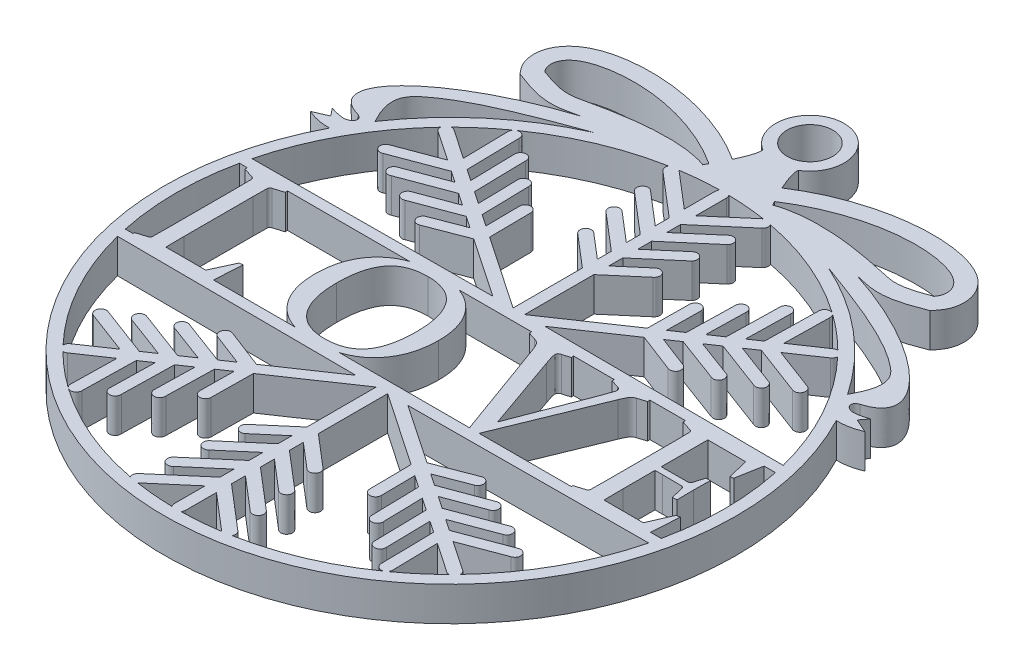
SolidWorks part; units mm, degrees
ref_plane "Front" through (0, 0, 0) normal (0, 0, 1) x (1, 0, 0)
ref_plane "Top" through (0, 0, 0) normal (0, 1, 0) x (1, 0, 0)
ref_plane "Right" through (0, 0, 0) normal (1, 0, 0) x (0, 0, -1)
sketch "Sketch2" plane through (0, 0, 0) normal (0, 1, 0) x (1, 0, 0)
  line L0 (0, -40) -> (0, 40) construction
  line L1 (-1.5513, 28.9322) -> (-1.4355, 28.0386) construction
  line L2 (-1.4355, 28.0386) -> (-3.2765, 24.7844) construction
  line L3 (-25, 0) -> (25, 0) construction
  line L4 (-23.5816, 13.2421) -> (-23.0551, 12.5703)
  line L5 (-23.0551, 12.5703) -> (-24.2994, 12.0278)
  line L6 (1.5513, 28.9322) -> (1.4355, 28.0386) construction
  line L7 (1.4355, 28.0386) -> (3.2765, 24.7844) construction
  line L8 (23.0551, 12.5703) -> (24.2994, 12.0278)
  line L9 (23.5816, 13.2421) -> (23.0551, 12.5703)
  circle A0 centre (0, 0) radius 25
  circle A1 centre (0, 31.5) radius 3
  circle A2 centre (0, 31.5) radius 2
  spline S0 degree 2 poles (-1.5513, 28.9322) (-1.4355, 28.0386) (-3.2765, 24.7844) knots 0 0 0 1 1 1
  spline S1 degree 3 poles (-20.6762, 14.0533) (-22.1036, 16.6017) (-19.7069, 19.1431) (-14.9545, 21.2685) (-6.9225, 24.0225) knots 0 0 0 0 0.333759 1 1 1 1
  spline S2 degree 3 poles (-2.8625, 25.5162) (-5.0851, 26.981) (-8.4172, 28.2104) (-13.6179, 28.5846) (-17.3038, 27.8244) (-17.5189, 25.8959) (-17.0454, 25.3119) knots 0.352292 0.352292 0.352292 0.352292 0.605498 0.656456 0.861874 1 1 1 1
  spline S3 degree 3 poles (-17.0454, 25.3119) (-14.9087, 24.481) (-13.5639, 24.7008) (-11.9333, 25.1069) (-8.4964, 25.7) (-5.0745, 25.9342) (-3.0588, 25.1693) knots 0 0 0 0 0.312735 0.538742 0.603058 0.955894 0.955894 0.955894 0.955894
  spline S4 degree 3 poles (21.9849, 13.3203) (22.1277, 13.5754) (22.4052, 14.1154) (22.7907, 15.0833) (23.0346, 16.2585) (22.7929, 17.6393) (22.101, 18.6611) (21.3618, 19.2961) (20.4903, 19.9352) (19.1911, 20.7514) (17.2586, 21.7212) (15.196, 22.5997) (13.1968, 23.3764) (11.5041, 24.0041) (9.9548, 24.5574) (8.8094, 24.958) (8.0923, 25.2065) (7.661, 25.355) (7.409, 25.4414) knots 0 0 0 0 0.03125 0.0625 0.125 0.1875 0.25 0.3125 0.375 0.5 0.625 0.75 0.8125 0.875 0.9375 0.964353 0.978612 1 1 1 1 construction
  spline S5 degree 3 poles (12.1078, 23.5145) (20.9973, 20.6606) (26.5831, 15.1958) (21.9849, 13.8893) knots 0.159399 0.159399 0.159399 0.159399 0.848923 0.848923 0.848923 0.848923
  spline S6 degree 3 poles (-2.1123, 26.8423) (-3.7352, 27.9119) (-6.4655, 29.1184) (-10.2583, 29.8928) (-13.084, 30.013) (-15.2668, 29.7046) (-16.7949, 29.1431) (-17.8412, 28.4814) (-18.6487, 27.4403) (-18.9074, 26.3618) (-18.7916, 25.4645) (-18.5606, 24.8375) (-18.1909, 24.3381) (-18.0722, 24.1975) (-17.996, 24.1025) (-17.96, 24.0581) knots 0.352292 0.352292 0.352292 0.352292 0.520312 0.604321 0.688331 0.772341 0.814346 0.85635 0.898355 0.94036 0.961362 0.982365 1.003367 1.013868 1.02437 1.02437 1.02437 1.02437
  spline S7 degree 3 poles (-17.96, 24.0581) (-17.5452, 23.8968) (-16.6622, 23.5595) (-15.608, 23.2763) (-14.6788, 23.1423) (-13.863, 23.1573) (-13.1986, 23.2698) (-12.7285, 23.3761) (-12.3212, 23.4677) (-11.9543, 23.5484) (-11.5324, 23.6374) (-10.9181, 23.7583) (-9.7068, 23.9714) (-8.2109, 24.1695) (-6.8748, 24.2333) (-6.3289, 24.2308) (-6.1677, 24.2272) knots -0.018096 -0.018096 -0.018096 -0.018096 0.042779 0.103653 0.164528 0.225402 0.286276 0.347151 0.402446 0.432883 0.468899 0.529774 0.590648 0.712397 0.773271 0.799158 0.799158 0.799158 0.799158
  spline S8 degree 2 poles (24.2994, 12.0278) (23.2006, 11.561) (22.1374, 11.6161) knots 0 0 0 0.62225 0.62225 0.62225
  spline S9 degree 3 poles (-21.9849, 13.3203) (-22.1277, 13.5754) (-22.4052, 14.1154) (-22.7907, 15.0833) (-23.0346, 16.2585) (-22.7929, 17.6393) (-22.101, 18.6611) (-21.3618, 19.2961) (-20.4903, 19.9352) (-19.1911, 20.7514) (-17.2586, 21.7212) (-15.196, 22.5997) (-13.1968, 23.3764) (-11.5041, 24.0041) (-9.9548, 24.5574) (-8.8094, 24.958) (-8.0923, 25.2065) (-7.661, 25.355) (-7.409, 25.4414) knots 0 0 0 0 0.03125 0.0625 0.125 0.1875 0.25 0.3125 0.375 0.5 0.625 0.75 0.8125 0.875 0.9375 0.964353 0.978612 1 1 1 1 construction
  spline S10 degree 3 poles (-7.409, 25.4414) (-7.4118, 25.4404) (-8.0863, 25.2093) (-8.4188, 25.0933) knots 0 0 0 0 0.024048 0.024048 0.024048 0.024048
  spline S11 degree 3 poles (-21.9849, 13.8893) (-21.4255, 13.6594) (-21.5668, 13.144) (-22.3704, 12.916) (-23.1797, 13.0883) (-23.5816, 13.2421) knots 0 0 0 0 0.635839 0.735839 1 1 1 1
  spline S12 degree 2 poles (-24.2994, 12.0278) (-23.2006, 11.561) (-22.1374, 11.6161) knots 0 0 0 0.62225 0.62225 0.62225
  spline S13 degree 3 poles (-12.1078, 23.5145) (-20.9973, 20.6606) (-26.5831, 15.1958) (-21.9849, 13.8893) knots 0.159399 0.159399 0.159399 0.159399 0.848923 0.848923 0.848923 0.848923
  spline S14 degree 3 poles (21.9849, 13.8893) (21.4255, 13.6594) (21.5668, 13.144) (22.3704, 12.916) (23.1797, 13.0883) (23.5816, 13.2421) knots 0 0 0 0 0.635839 0.735839 1 1 1 1
  spline S15 degree 3 poles (7.409, 25.4414) (7.4118, 25.4404) (8.0863, 25.2093) (8.4188, 25.0933) knots 0 0 0 0 0.024048 0.024048 0.024048 0.024048
  spline S16 degree 3 poles (17.96, 24.0581) (17.5452, 23.8968) (16.6622, 23.5595) (15.608, 23.2763) (14.6788, 23.1423) (13.863, 23.1573) (13.1986, 23.2698) (12.7285, 23.3761) (12.3212, 23.4677) (11.9543, 23.5484) (11.5324, 23.6374) (10.9181, 23.7583) (9.7068, 23.9714) (8.2109, 24.1695) (6.8748, 24.2333) (6.3289, 24.2308) (6.1677, 24.2272) knots -0.018096 -0.018096 -0.018096 -0.018096 0.042779 0.103653 0.164528 0.225402 0.286276 0.347151 0.402446 0.432883 0.468899 0.529774 0.590648 0.712397 0.773271 0.799158 0.799158 0.799158 0.799158
  spline S17 degree 3 poles (2.1123, 26.8423) (3.7352, 27.9119) (6.4655, 29.1184) (10.2583, 29.8928) (13.084, 30.013) (15.2668, 29.7046) (16.7949, 29.1431) (17.8412, 28.4814) (18.6487, 27.4403) (18.9074, 26.3618) (18.7916, 25.4645) (18.5606, 24.8375) (18.1909, 24.3381) (18.0722, 24.1975) (17.996, 24.1025) (17.96, 24.0581) knots 0.352292 0.352292 0.352292 0.352292 0.520312 0.604321 0.688331 0.772341 0.814346 0.85635 0.898355 0.94036 0.961362 0.982365 1.003367 1.013868 1.02437 1.02437 1.02437 1.02437
  spline S18 degree 3 poles (17.0454, 25.3119) (14.9087, 24.481) (13.5639, 24.7008) (11.9333, 25.1069) (8.4964, 25.7) (5.0745, 25.9342) (3.0588, 25.1693) knots 0 0 0 0 0.312735 0.538742 0.603058 0.955894 0.955894 0.955894 0.955894
  spline S19 degree 3 poles (2.8625, 25.5162) (5.0851, 26.981) (8.4172, 28.2104) (13.6179, 28.5846) (17.3038, 27.8244) (17.5189, 25.8959) (17.0454, 25.3119) knots 0.352292 0.352292 0.352292 0.352292 0.605498 0.656456 0.861874 1 1 1 1
  spline S20 degree 3 poles (20.6762, 14.0533) (22.1036, 16.6017) (19.7069, 19.1431) (14.9545, 21.2685) (6.9225, 24.0225) knots 0 0 0 0 0.333759 1 1 1 1
  spline S21 degree 2 poles (1.5513, 28.9322) (1.4355, 28.0386) (3.2765, 24.7844) knots 0 0 0 1 1 1
  point P5 (0, 0)
sketch "Sketch3" plane through (0, 0, 0) normal (0, 1, 0) x (1, 0, 0)
  line L0 (-24.1349, 0) -> (24.1349, 0) construction
  line L2 (0, -40) -> (0, 40) construction
  line L3 (-0.5022, -6) -> (0.5022, -6) construction
  line L5 (-14.034, -15.1774) -> (-13.0234, -14.492) construction
  line L8 (-12.03, -13.8183) -> (-11.0201, -13.1334) construction
  line L9 (-9.9505, -12.408) -> (-8.9402, -11.7227) construction
  line L10 (-7.9131, -11.0261) -> (-6.9051, -10.3425) construction
  line L11 (-7.4472, -14.0019) -> (-7.4091, -10.6843) construction
  line L22 (-9.5313, -15.9262) -> (-9.4454, -12.0654) construction
  line L30 (-11.6104, -17.755) -> (-11.5251, -13.4758) construction
  line L31 (-9.9505, -12.408) -> (-11.0201, -13.1334)
  line L34 (-13.6099, -19.1638) -> (-13.5287, -14.8347) construction
  line L35 (-14.034, -15.1774) -> (-16.6227, -16.9331)
  line L39 (-2.2838, -6) -> (-0.5022, -6) construction
  line L40 (-0.7828, -5.5862) -> (-16.9034, -16.5193) construction
  line L41 (-2.2838, -6) -> (-7.4664, -9.5149)
  line L42 (-12.03, -13.8183) -> (-13.0234, -14.492)
  line L43 (-18.1421, -12.4812) -> (-14.09, -14.0071) construction
  line L44 (-7.9131, -11.0261) -> (-8.9402, -11.7227)
  line L45 (-0.5022, -6) -> (-1.0635, -5.1724) construction
  line L46 (14.5953, -14.3498) -> (13.5847, -13.6643) construction
  line L47 (-16.0936, -11.1447) -> (-12.0864, -12.6482) construction
  line L48 (-7.9131, -11.0261) -> (-7.9472, -13.9949)
  line L49 (-13.6255, -9.8895) -> (-10.0067, -11.2377) construction
  line L51 (-11.0668, -8.665) -> (-7.9704, -9.8567) construction
  line L63 (-8.4743, -10.1985) -> (-7.4664, -9.5149) construction
  line L64 (-10.5118, -11.5803) -> (-9.5015, -10.8951) construction
  line L65 (-12.5913, -12.9907) -> (-11.5814, -12.3057) construction
  line L66 (-14.5953, -14.3498) -> (-13.5847, -13.6643) construction
  line L67 (-13.5847, -13.6643) -> (-17.9319, -12.0275)
  line L68 (-7.4664, -9.5149) -> (-10.8883, -8.1979)
  line L69 (-9.5015, -10.8951) -> (-13.3999, -9.4433)
  line L70 (-11.5814, -12.3057) -> (-15.8731, -10.6959)
  line L71 (-9.9505, -12.408) -> (-10.028, -15.8688)
  line L72 (-12.03, -13.8183) -> (-12.1079, -17.7047)
  line L73 (-14.5953, -14.3498) -> (-18.2881, -12.9594)
  line L74 (-12.5913, -12.9907) -> (-16.2309, -11.6254)
  line L75 (-10.5118, -11.5803) -> (-13.7559, -10.3722)
  line L76 (-8.4743, -10.1985) -> (-11.2452, -9.132)
  line L77 (-8.4743, -10.1985) -> (-9.5015, -10.8951)
  line L78 (-0.5022, -6) -> (-6.9051, -10.3425)
  line L79 (-12.5913, -12.9907) -> (-13.5847, -13.6643)
  line L80 (-14.5953, -14.3498) -> (-17.184, -16.1055)
  line L81 (-10.5118, -11.5803) -> (-11.5814, -12.3057)
  line L82 (12.5913, -12.9907) -> (11.5814, -12.3057) construction
  line L83 (10.5118, -11.5803) -> (9.5015, -10.8951) construction
  line L84 (8.4743, -10.1985) -> (7.4664, -9.5149) construction
  line L85 (11.0668, -8.665) -> (7.9704, -9.8567) construction
  line L86 (-14.034, -15.1774) -> (-14.1082, -19.1225)
  line L87 (13.6255, -9.8895) -> (10.0067, -11.2377) construction
  line L88 (16.0936, -11.1447) -> (12.0864, -12.6482) construction
  line L89 (0.5022, -6) -> (1.0635, -5.1724) construction
  line L90 (18.1421, -12.4812) -> (14.09, -14.0071) construction
  line L91 (0.7828, -5.5862) -> (16.9034, -16.5193) construction
  line L92 (2.2838, -6) -> (0.5022, -6) construction
  line L93 (13.6099, -19.1638) -> (13.5287, -14.8347) construction
  line L94 (11.6104, -17.755) -> (11.5251, -13.4758) construction
  line L95 (9.5313, -15.9262) -> (9.4454, -12.0654) construction
  line L96 (7.4472, -14.0019) -> (7.4091, -10.6843) construction
  line L97 (7.9131, -11.0261) -> (6.9051, -10.3425) construction
  line L98 (9.9505, -12.408) -> (8.9402, -11.7227) construction
  line L99 (12.03, -13.8183) -> (11.0201, -13.1334) construction
  line L100 (14.034, -15.1774) -> (13.0234, -14.492) construction
  line L101 (-0.5022, -13.3802) -> (-0.5022, -14.6022)
  line L102 (-0.5022, -14.6022) -> (-3.7641, -17.3917)
  line L103 (23.4056, -5.8885) -> (23.6113, -5)
  line L104 (0.5022, -20.994) -> (3.6955, -23.7248)
  line L105 (23.4056, -5.8885) -> (2.2838, -6)
  line L106 (0.5022, -6) -> (0.5022, -12.0665)
  line L107 (-11.0201, -13.1334) -> (-11.112, -17.7161)
  line L108 (-8.9402, -11.7227) -> (-9.0333, -15.8817)
  line L109 (-6.9051, -10.3425) -> (-6.9473, -14.0089)
  line L110 (-0.5022, -12.0665) -> (-3.2976, -14.457)
  line L111 (0.5022, -20.994) -> (0.5022, -23.6884)
  line L112 (-0.5022, -15.9167) -> (-0.5022, -17.1387)
  line L113 (13.0234, -14.492) -> (13.1107, -19.1364)
  line L114 (-0.5022, -13.3802) -> (-2.7221, -15.2785)
  line L115 (-0.5022, -19.674) -> (-4.3475, -22.9624)
  line L116 (-0.5022, -17.1387) -> (-4.0537, -20.1758)
  line L117 (-0.5022, -18.452) -> (-3.3506, -20.8878)
  line L118 (-0.5022, -15.9167) -> (-3.0462, -18.0922)
  line L119 (0.5022, -18.452) -> (0.5022, -19.674)
  line L120 (-0.5022, -18.452) -> (-0.5022, -19.674)
  line L121 (0.5022, -15.9167) -> (3.0462, -18.0922)
  line L122 (0.5022, -18.452) -> (3.3506, -20.8878)
  line L123 (-13.0234, -14.492) -> (-13.1107, -19.1364)
  line L124 (-0.5022, -20.994) -> (-0.5022, -23.6884)
  line L125 (0.5022, -17.1387) -> (4.0537, -20.1758)
  line L126 (-0.5022, -6) -> (-0.5022, -12.0665)
  line L127 (-23.4056, -5.8885) -> (-2.2838, -6)
  line L128 (-0.5022, -20.994) -> (-3.6955, -23.7248)
  line L129 (-23.6113, -5) -> (23.6113, -5)
  line L130 (0.5022, -19.674) -> (4.3475, -22.9624)
  line L131 (-23.4056, -5.8885) -> (-23.6113, -5)
  line L132 (0.5022, -13.3802) -> (2.7221, -15.2785)
  line L133 (0.5022, -15.9167) -> (0.5022, -17.1387)
  line L139 (0.5022, -12.0665) -> (3.2976, -14.457)
  line L141 (6.9051, -10.3425) -> (6.9473, -14.0089)
  line L174 (8.9402, -11.7227) -> (9.0333, -15.8817)
  line L175 (11.0201, -13.1334) -> (11.112, -17.7161)
  line L176 (0.5022, -14.6022) -> (3.7641, -17.3917)
  line L177 (0.5022, -13.3802) -> (0.5022, -14.6022)
  line L178 (14.034, -15.1774) -> (14.1082, -19.1225)
  line L179 (10.5118, -11.5803) -> (11.5814, -12.3057)
  line L180 (14.5953, -14.3498) -> (17.184, -16.1055)
  line L181 (12.5913, -12.9907) -> (13.5847, -13.6643)
  line L182 (0.5022, -6) -> (6.9051, -10.3425)
  line L183 (8.4743, -10.1985) -> (9.5015, -10.8951)
  line L184 (8.4743, -10.1985) -> (11.2452, -9.132)
  line L185 (10.5118, -11.5803) -> (13.7559, -10.3722)
  line L186 (12.5913, -12.9907) -> (16.2309, -11.6254)
  line L187 (14.5953, -14.3498) -> (18.2881, -12.9594)
  line L188 (12.03, -13.8183) -> (12.1079, -17.7047)
  line L189 (9.9505, -12.408) -> (10.028, -15.8688)
  line L190 (11.5814, -12.3057) -> (15.8731, -10.6959)
  line L191 (9.5015, -10.8951) -> (13.3999, -9.4433)
  line L192 (7.4664, -9.5149) -> (10.8883, -8.1979)
  line L193 (13.5847, -13.6643) -> (17.9319, -12.0275)
  line L194 (7.9131, -11.0261) -> (7.9472, -13.9949)
  line L195 (7.9131, -11.0261) -> (8.9402, -11.7227)
  line L196 (12.03, -13.8183) -> (13.0234, -14.492)
  line L197 (2.2838, -6) -> (7.4664, -9.5149)
  line L198 (14.034, -15.1774) -> (16.6227, -16.9331)
  line L199 (9.9505, -12.408) -> (11.0201, -13.1334)
  line L200 (-0.9226, 0) -> (1.3603, 0) construction
  line L201 (14.034, 15.1774) -> (13.0234, 14.492) construction
  line L202 (12.03, 13.8183) -> (11.0201, 13.1334) construction
  line L203 (9.9505, 12.408) -> (8.9402, 11.7227) construction
  line L204 (7.9131, 11.0261) -> (6.9051, 10.3425) construction
  line L205 (7.4472, 14.0019) -> (7.4091, 10.6843) construction
  line L206 (9.5313, 15.9262) -> (9.4454, 12.0654) construction
  line L207 (11.6104, 17.755) -> (11.5251, 13.4758) construction
  line L208 (13.6099, 19.1638) -> (13.5287, 14.8347) construction
  line L209 (2.2838, 6) -> (0.5022, 6) construction
  line L210 (0.7828, 5.5862) -> (16.9034, 16.5193) construction
  line L211 (18.1421, 12.4812) -> (14.09, 14.0071) construction
  line L212 (0.5022, 6) -> (1.0635, 5.1724) construction
  line L213 (16.0936, 11.1447) -> (12.0864, 12.6482) construction
  line L214 (13.6255, 9.8895) -> (10.0067, 11.2377) construction
  line L215 (11.0668, 8.665) -> (7.9704, 9.8567) construction
  line L216 (8.4743, 10.1985) -> (7.4664, 9.5149) construction
  line L217 (10.5118, 11.5803) -> (9.5015, 10.8951) construction
  line L218 (12.5913, 12.9907) -> (11.5814, 12.3057) construction
  line L219 (-14.5953, 14.3498) -> (-13.5847, 13.6643) construction
  line L220 (-12.5913, 12.9907) -> (-11.5814, 12.3057) construction
  line L221 (-10.5118, 11.5803) -> (-9.5015, 10.8951) construction
  line L222 (-8.4743, 10.1985) -> (-7.4664, 9.5149) construction
  line L223 (-11.0668, 8.665) -> (-7.9704, 9.8567) construction
  line L224 (-13.6255, 9.8895) -> (-10.0067, 11.2377) construction
  line L225 (-16.0936, 11.1447) -> (-12.0864, 12.6482) construction
  line L226 (14.5953, 14.3498) -> (13.5847, 13.6643) construction
  line L227 (-0.5022, 6) -> (-1.0635, 5.1724) construction
  line L228 (-18.1421, 12.4812) -> (-14.09, 14.0071) construction
  line L229 (-0.7828, 5.5862) -> (-16.9034, 16.5193) construction
  line L230 (-2.2838, 6) -> (-0.5022, 6) construction
  line L231 (-13.6099, 19.1638) -> (-13.5287, 14.8347) construction
  line L232 (-11.6104, 17.755) -> (-11.5251, 13.4758) construction
  line L233 (-9.5313, 15.9262) -> (-9.4454, 12.0654) construction
  line L234 (-7.4472, 14.0019) -> (-7.4091, 10.6843) construction
  line L235 (-7.9131, 11.0261) -> (-6.9051, 10.3425) construction
  line L236 (-9.9505, 12.408) -> (-8.9402, 11.7227) construction
  line L237 (-12.03, 13.8183) -> (-11.0201, 13.1334) construction
  line L238 (-14.034, 15.1774) -> (-13.0234, 14.492) construction
  line L239 (-0.5022, 6) -> (0.5022, 6) construction
  line L240 (9.9505, 12.408) -> (11.0201, 13.1334)
  line L241 (14.034, 15.1774) -> (16.6227, 16.9331)
  line L242 (2.2838, 6) -> (7.4664, 9.5149)
  line L243 (12.03, 13.8183) -> (13.0234, 14.492)
  line L244 (7.9131, 11.0261) -> (8.9402, 11.7227)
  line L245 (7.9131, 11.0261) -> (7.9472, 13.9949)
  line L246 (13.5847, 13.6643) -> (17.9319, 12.0275)
  line L247 (7.4664, 9.5149) -> (10.8883, 8.1979)
  line L248 (9.5015, 10.8951) -> (13.3999, 9.4433)
  line L249 (11.5814, 12.3057) -> (15.8731, 10.6959)
  line L250 (9.9505, 12.408) -> (10.028, 15.8688)
  line L251 (12.03, 13.8183) -> (12.1079, 17.7047)
  line L252 (14.5953, 14.3498) -> (18.2881, 12.9594)
  line L253 (12.5913, 12.9907) -> (16.2309, 11.6254)
  line L254 (10.5118, 11.5803) -> (13.7559, 10.3722)
  line L255 (8.4743, 10.1985) -> (11.2452, 9.132)
  line L256 (8.4743, 10.1985) -> (9.5015, 10.8951)
  line L257 (0.5022, 6) -> (6.9051, 10.3425)
  line L258 (12.5913, 12.9907) -> (13.5847, 13.6643)
  line L259 (14.5953, 14.3498) -> (17.184, 16.1055)
  line L260 (10.5118, 11.5803) -> (11.5814, 12.3057)
  line L261 (14.034, 15.1774) -> (14.1082, 19.1225)
  line L262 (0.5022, 13.3802) -> (0.5022, 14.6022)
  line L263 (0.5022, 14.6022) -> (3.7641, 17.3917)
  line L264 (11.0201, 13.1334) -> (11.112, 17.7161)
  line L265 (8.9402, 11.7227) -> (9.0333, 15.8817)
  line L266 (6.9051, 10.3425) -> (6.9473, 14.0089)
  line L267 (0.5022, 12.0665) -> (3.2976, 14.457)
  line L268 (0.5022, 15.9167) -> (0.5022, 17.1387)
  line L269 (0.5022, 13.3802) -> (2.7221, 15.2785)
  line L270 (-23.4056, 5.8885) -> (-23.6113, 5)
  line L271 (0.5022, 19.674) -> (4.3475, 22.9624)
  line L272 (-23.6113, 5) -> (23.6113, 5)
  line L273 (-0.5022, 20.994) -> (-3.6955, 23.7248)
  line L274 (-23.4056, 5.8885) -> (-2.2838, 6)
  line L275 (-0.5022, 6) -> (-0.5022, 12.0665)
  line L276 (0.5022, 17.1387) -> (4.0537, 20.1758)
  line L277 (-0.5022, 20.994) -> (-0.5022, 23.6884)
  line L278 (-13.0234, 14.492) -> (-13.1107, 19.1364)
  line L279 (0.5022, 18.452) -> (3.3506, 20.8878)
  line L280 (0.5022, 15.9167) -> (3.0462, 18.0922)
  line L281 (-0.5022, 18.452) -> (-0.5022, 19.674)
  line L282 (0.5022, 18.452) -> (0.5022, 19.674)
  line L283 (-0.5022, 15.9167) -> (-3.0462, 18.0922)
  line L284 (-0.5022, 18.452) -> (-3.3506, 20.8878)
  line L285 (-0.5022, 17.1387) -> (-4.0537, 20.1758)
  line L286 (-0.5022, 19.674) -> (-4.3475, 22.9624)
  line L287 (-0.5022, 13.3802) -> (-2.7221, 15.2785)
  line L288 (13.0234, 14.492) -> (13.1107, 19.1364)
  line L289 (-0.5022, 15.9167) -> (-0.5022, 17.1387)
  line L290 (0.5022, 20.994) -> (0.5022, 23.6884)
  line L291 (-0.5022, 12.0665) -> (-3.2976, 14.457)
  line L292 (-6.9051, 10.3425) -> (-6.9473, 14.0089)
  line L293 (-8.9402, 11.7227) -> (-9.0333, 15.8817)
  line L294 (-11.0201, 13.1334) -> (-11.112, 17.7161)
  line L295 (0.5022, 6) -> (0.5022, 12.0665)
  line L296 (23.4056, 5.8885) -> (2.2838, 6)
  line L297 (0.5022, 20.994) -> (3.6955, 23.7248)
  line L298 (23.4056, 5.8885) -> (23.6113, 5)
  line L299 (-0.5022, 14.6022) -> (-3.7641, 17.3917)
  line L300 (-0.5022, 13.3802) -> (-0.5022, 14.6022)
  line L301 (-14.034, 15.1774) -> (-14.1082, 19.1225)
  line L302 (-10.5118, 11.5803) -> (-11.5814, 12.3057)
  line L303 (-14.5953, 14.3498) -> (-17.184, 16.1055)
  line L304 (-12.5913, 12.9907) -> (-13.5847, 13.6643)
  line L305 (-0.5022, 6) -> (-6.9051, 10.3425)
  line L306 (-8.4743, 10.1985) -> (-9.5015, 10.8951)
  line L307 (-8.4743, 10.1985) -> (-11.2452, 9.132)
  line L308 (-10.5118, 11.5803) -> (-13.7559, 10.3722)
  line L309 (-12.5913, 12.9907) -> (-16.2309, 11.6254)
  line L310 (-14.5953, 14.3498) -> (-18.2881, 12.9594)
  line L311 (-12.03, 13.8183) -> (-12.1079, 17.7047)
  line L312 (-9.9505, 12.408) -> (-10.028, 15.8688)
  line L313 (-11.5814, 12.3057) -> (-15.8731, 10.6959)
  line L314 (-9.5015, 10.8951) -> (-13.3999, 9.4433)
  line L315 (-7.4664, 9.5149) -> (-10.8883, 8.1979)
  line L316 (-13.5847, 13.6643) -> (-17.9319, 12.0275)
  line L317 (-7.9131, 11.0261) -> (-7.9472, 13.9949)
  line L318 (-7.9131, 11.0261) -> (-8.9402, 11.7227)
  line L319 (-12.03, 13.8183) -> (-13.0234, 14.492)
  line L320 (-2.2838, 6) -> (-7.4664, 9.5149)
  line L321 (-14.034, 15.1774) -> (-16.6227, 16.9331)
  line L322 (-9.9505, 12.408) -> (-11.0201, 13.1334)
  arc A0 (-0.5022, -23.6884) -> (0.5022, -23.6884) centre (0, -23.6884) ccw
  circle A1 centre (0, 0) radius 23.6349 construction
  circle A6 centre (0, 0) radius 24.1349 construction
  arc A12 (-10.8883, -8.1979) -> (-11.2452, -9.132) centre (-11.0668, -8.665) ccw
  arc A14 (-13.3999, -9.4433) -> (-13.7559, -10.3722) centre (-13.6255, -9.8895) ccw
  arc A16 (-15.8731, -10.6959) -> (-16.2309, -11.6254) centre (-16.0936, -11.1447) ccw
  arc A18 (-17.184, -16.1055) -> (-16.6227, -16.9331) centre (-16.9034, -16.5193) ccw
  arc A20 (-17.9319, -12.0275) -> (-18.2881, -12.9594) centre (-18.1421, -12.4812) ccw
  arc A21 (10.8883, 8.1979) -> (11.2452, 9.132) centre (11.0668, 8.665) ccw
  arc A22 (3.3506, -20.8878) -> (4.0537, -20.1758) centre (3.7277, -20.5571) ccw
  arc A23 (-3.6955, 23.7248) -> (-4.3475, 22.9624) centre (-4.0215, 23.3436) ccw
  arc A24 (3.0462, -18.0922) -> (3.7641, -17.3917) centre (3.3994, -17.7361) ccw
  arc A25 (2.7221, -15.2785) -> (3.2976, -14.457) centre (3.003, -14.8629) ccw
  arc A27 (6.9473, -14.0089) -> (7.9472, -13.9949) centre (7.4472, -14.0019) ccw
  arc A29 (9.0333, -15.8817) -> (10.028, -15.8688) centre (9.5313, -15.9262) ccw
  arc A31 (11.112, -17.7161) -> (12.1079, -17.7047) centre (11.6104, -17.755) ccw
  arc A33 (13.1107, -19.1364) -> (14.1082, -19.1225) centre (13.6099, -19.1638) ccw
  arc A35 (3.6955, -23.7248) -> (4.3475, -22.9624) centre (4.0215, -23.3436) ccw
  arc A36 (17.9319, -12.0275) -> (18.2881, -12.9594) centre (18.1421, -12.4812) cw
  arc A38 (-13.1107, -19.1364) -> (-14.1082, -19.1225) centre (-13.6099, -19.1638) cw
  arc A39 (-11.112, -17.7161) -> (-12.1079, -17.7047) centre (-11.6104, -17.755) cw
  arc A40 (-9.0333, -15.8817) -> (-10.028, -15.8688) centre (-9.5313, -15.9262) cw
  arc A41 (-6.9473, -14.0089) -> (-7.9472, -13.9949) centre (-7.4472, -14.0019) cw
  arc A42 (-2.7221, -15.2785) -> (-3.2976, -14.457) centre (-3.003, -14.8629) cw
  arc A43 (17.184, -16.1055) -> (16.6227, -16.9331) centre (16.9034, -16.5193) cw
  arc A44 (-3.0462, -18.0922) -> (-3.7641, -17.3917) centre (-3.3994, -17.7361) cw
  arc A45 (15.8731, -10.6959) -> (16.2309, -11.6254) centre (16.0936, -11.1447) cw
  arc A46 (-3.3506, -20.8878) -> (-4.0537, -20.1758) centre (-3.7277, -20.5571) cw
  arc A47 (13.3999, -9.4433) -> (13.7559, -10.3722) centre (13.6255, -9.8895) cw
  arc A48 (-3.6955, -23.7248) -> (-4.3475, -22.9624) centre (-4.0215, -23.3436) cw
  arc A49 (10.8883, -8.1979) -> (11.2452, -9.132) centre (11.0668, -8.665) cw
  arc A50 (13.3999, 9.4433) -> (13.7559, 10.3722) centre (13.6255, 9.8895) ccw
  arc A51 (-3.3506, 20.8878) -> (-4.0537, 20.1758) centre (-3.7277, 20.5571) ccw
  arc A53 (15.8731, 10.6959) -> (16.2309, 11.6254) centre (16.0936, 11.1447) ccw
  arc A54 (-3.0462, 18.0922) -> (-3.7641, 17.3917) centre (-3.3994, 17.7361) ccw
  arc A55 (17.184, 16.1055) -> (16.6227, 16.9331) centre (16.9034, 16.5193) ccw
  arc A56 (-2.7221, 15.2785) -> (-3.2976, 14.457) centre (-3.003, 14.8629) ccw
  arc A57 (-6.9473, 14.0089) -> (-7.9472, 13.9949) centre (-7.4472, 14.0019) ccw
  arc A58 (-9.0333, 15.8817) -> (-10.028, 15.8688) centre (-9.5313, 15.9262) ccw
  arc A59 (-11.112, 17.7161) -> (-12.1079, 17.7047) centre (-11.6104, 17.755) ccw
  arc A61 (-13.1107, 19.1364) -> (-14.1082, 19.1225) centre (-13.6099, 19.1638) ccw
  arc A62 (17.9319, 12.0275) -> (18.2881, 12.9594) centre (18.1421, 12.4812) ccw
  arc A63 (3.6955, 23.7248) -> (4.3475, 22.9624) centre (4.0215, 23.3436) cw
  arc A64 (13.1107, 19.1364) -> (14.1082, 19.1225) centre (13.6099, 19.1638) cw
  arc A65 (11.112, 17.7161) -> (12.1079, 17.7047) centre (11.6104, 17.755) cw
  arc A66 (9.0333, 15.8817) -> (10.028, 15.8688) centre (9.5313, 15.9262) cw
  arc A67 (6.9473, 14.0089) -> (7.9472, 13.9949) centre (7.4472, 14.0019) cw
  arc A68 (2.7221, 15.2785) -> (3.2976, 14.457) centre (3.003, 14.8629) cw
  arc A70 (3.0462, 18.0922) -> (3.7641, 17.3917) centre (3.3994, 17.7361) cw
  arc A71 (3.3506, 20.8878) -> (4.0537, 20.1758) centre (3.7277, 20.5571) cw
  arc A72 (-17.9319, 12.0275) -> (-18.2881, 12.9594) centre (-18.1421, 12.4812) cw
  arc A73 (-17.184, 16.1055) -> (-16.6227, 16.9331) centre (-16.9034, 16.5193) cw
  arc A74 (-15.8731, 10.6959) -> (-16.2309, 11.6254) centre (-16.0936, 11.1447) cw
  arc A75 (-13.3999, 9.4433) -> (-13.7559, 10.3722) centre (-13.6255, 9.8895) cw
  arc A76 (-10.8883, 8.1979) -> (-11.2452, 9.132) centre (-11.0668, 8.665) cw
  arc A77 (-0.5022, 23.6884) -> (0.5022, 23.6884) centre (0, 23.6884) cw
  point P84 (0, -6)
  point P121 (0, -5)
  point P326 (0, 5)
  point P327 (0, 6)
  dimension "D5" = 1.3145
  dimension "D12" = 3.3474
  dimension "D13" = 4.292
  dimension "D31" = 3.4609
  dimension "D48" = 0.5016
  dimension "D3" = 1.32
  dimension "D4" = 1.3132
  dimension "D28" = 4.6444
  dimension "D14" = 2.9209
  dimension "D17" = 0.5022
  dimension "D35" = 0.5
  dimension "D37" = 3.6666
  dimension "D44" = 1.2221
  dimension "D16" = 2.6944
  dimension "D47" = 0.5016
  dimension "D49" = 2.7954
  dimension "D8" = 4.2017
  dimension "D9" = 5.0596
  dimension "D10" = 3.7479
  dimension "D11" = 4.6731
  dimension "D7" = 1.3137
  dimension "D15" = 3.6782
  dimension "D26" = 3.9451
  dimension "D29" = 3.8864
  dimension "D30" = 4.5827
  dimension "D32" = 4.1589
  dimension "D33" = 2.9688
  dimension "D34" = 3.6663
  dimension "D38" = 4.16
  dimension "D39" = 4.5836
  dimension "D40" = 4.6452
  dimension "D45" = 6.0665
extrude "Boss-Extrude2" add sketch "Sketch3" along normal mid plane 3
extrude "Boss-Extrude4" add sketch "Sketch2" along normal mid plane 3
sketch "Sketch8" plane through (0, 1.5, 0) normal (0, 1, 0) x (1, 0, 0)
  circle A2 centre (0, 0) radius 24
  circle A3 centre (0, 0) radius 24
  dimension "D1" = 1
extrude "Extrude-Thin2" add sketch "Sketch8" against normal blind 3 thin
sketch "Sketch10" plane through (0, 1.5, 0) normal (0, 1, 0) x (1, 0, 0)
  text T0 "LOVE" font "Constantia" height 10.2
extrude "Boss-Extrude5" add sketch "Sketch10" against normal blind 3
